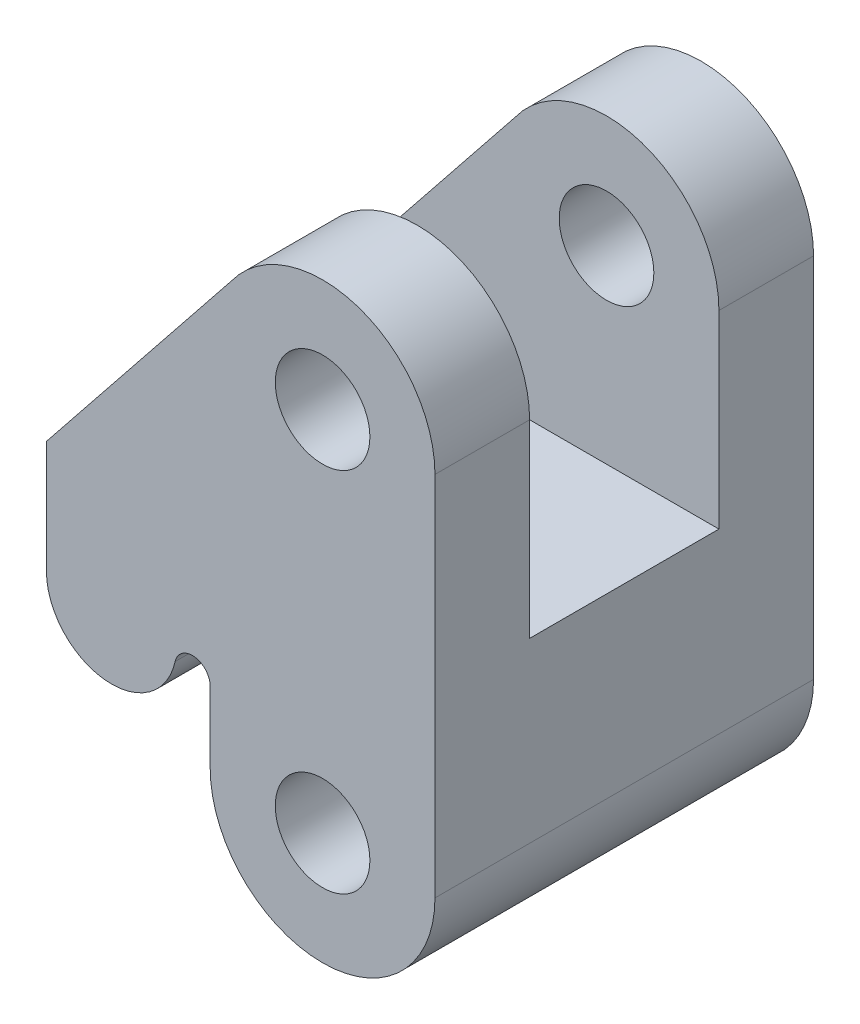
SolidWorks part; units mm, degrees
ref_plane "Plane1" through (0, 0, 0) normal (0, 0, 1) x (1, 0, 0)
ref_plane "Plane2" through (0, 0, 0) normal (0, 1, 0) x (1, 0, 0)
ref_plane "Plane3" through (0, 0, 0) normal (1, 0, 0) x (0, 0, -1)
sketch "Esquisse1" plane through (0, 0, 0) normal (0, 0, 1) x (1, 0, 0)
  line L0 (-37.1598, 19.0536) -> (-37.1598, 34.0536)
  line L1 (-56.1598, 19.0536) -> (-56.1598, 25.0536)
  line L2 (-70, 26.5406) -> (-70, 34.0536)
  line L3 (-70, 34.0536) -> (-37.1598, 34.0536)
  arc A0 (-37.1598, 19.0536) -> (-56.1598, 19.0536) centre (-46.6598, 19.0536) cw
  arc A1 (-56.1598, 25.0536) -> (-59.1255, 25.3722) centre (-57.6598, 25.0536) ccw
  arc A2 (-59.1255, 25.3722) -> (-70, 26.5406) centre (-64.5, 26.5406) cw
  dimension "D1" = 9.5
  dimension "D3" = 1.5
  dimension "D4" = 5.5
  dimension "D2" = 6
  dimension "D5" = 15
  dimension "D6" = 90
extrude "Base-Extrusion" add sketch "Esquisse1" along normal blind 32
sketch "Esquisse2" plane through (0, 0, 32) normal (0, 0, 1) x (1, 0, 0)
  line L0 (-70, 30.2971) -> (-37.1598, 30.2971)
  line L1 (-70, 26.5406) -> (-70, 34.0536) construction
  line L2 (-37.1598, 19.0536) -> (-37.1598, 34.0536) construction
  line L3 (-37.1598, 30.2971) -> (-37.1598, 50.0536)
  line L6 (-70, 30.2971) -> (-70, 36.0536)
  line L7 (-70, 34.0536) -> (-37.1598, 34.0536) construction
  line L8 (-70, 36.0536) -> (-54.347, 55.6353)
  arc A0 (-37.1598, 50.0536) -> (-54.347, 55.6353) centre (-46.6598, 50.0536) ccw
  dimension "D1" = 2
  dimension "D3" = 9.5
  dimension "D2" = 16
extrude "Boss.-Extru.11" add sketch "Esquisse2" against normal blind 8
pattern_linear "Répétition linéaire1" count 2 spacing 24
sketch "Esquisse3" plane through (0, 0, 32) normal (0, 0, 1) x (1, 0, 0)
  circle A0 centre (-46.6598, 50.0536) radius 4
  circle A1 centre (-46.6598, 19.0536) radius 4
  dimension "D1" = 8
  dimension "D2" = 8
extrude "Enlèv. mat.-Extru.1" cut sketch "Esquisse3" against normal through all
